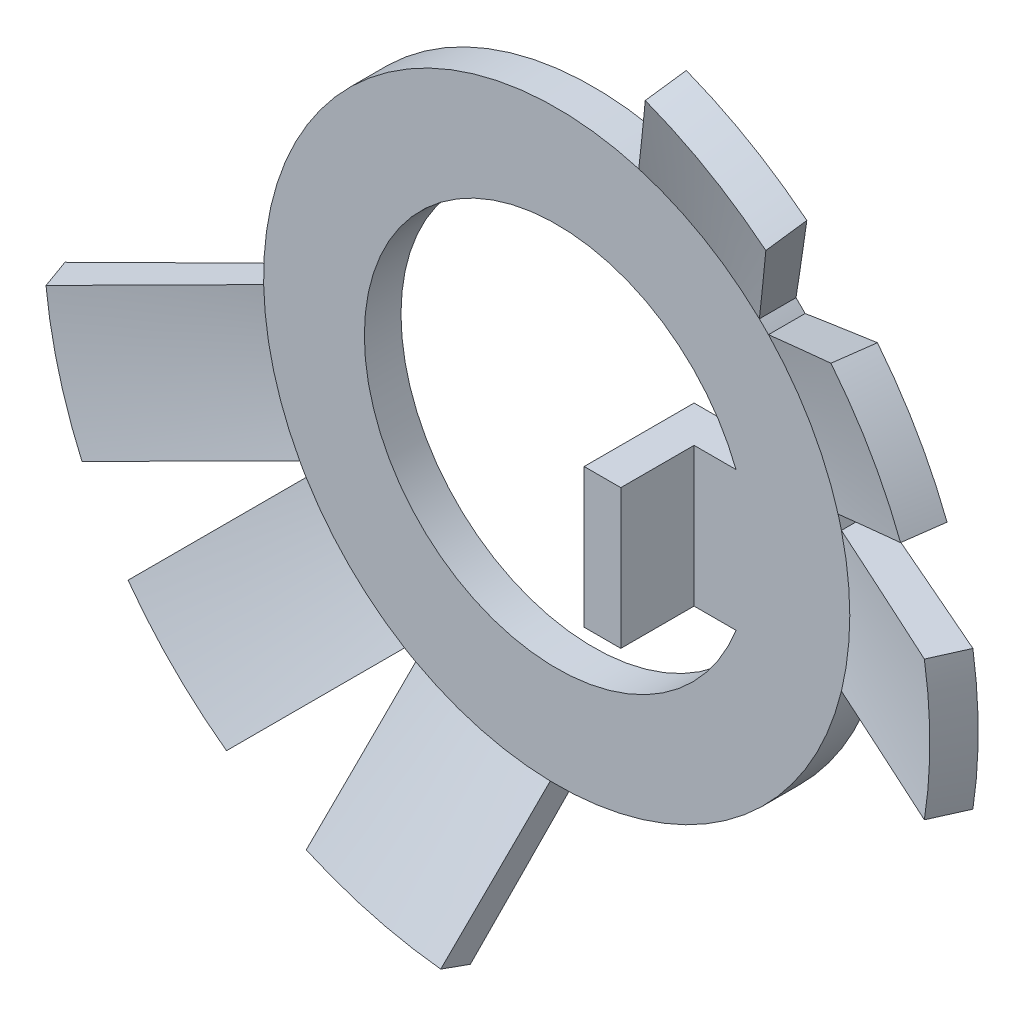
SolidWorks part; units mm, degrees
ref_plane "Front" through (0, 0, 0) normal (0, 0, 1) x (1, 0, 0)
ref_plane "Top" through (0, 0, 0) normal (0, 1, 0) x (1, 0, 0)
ref_plane "Right" through (0, 0, 0) normal (1, 0, 0) x (0, 0, -1)
other "Configuration Table"
sketch "Sketch1" plane through (0, 0, 0) normal (1, 0, 0) x (0, 1, 0)
  line L0 (0, -2.9094) -> (-8, -2.9094)
  line L1 (-8, -2.9094) -> (-12.5, -0.9142)
  line L2 (0, 5.8236) -> (0, -8.1378) construction
  line L4 (-12.0947, 0) -> (-8, -1.9094)
  line L5 (-8, -1.9094) -> (0, -1.9094)
  line L6 (0, -1.9094) -> (0, -2.9094)
  line L7 (-12.5, -0.9142) -> (-12.0947, 0)
revolve "Base-Extrude" add sketch "Sketch1" angle 360 about L2
sketch "Sketch2" plane through (-2.4044, 1.0036, -2.9094) normal (0, 0, -1) x (-1, 0, 0)
  line L0 (-7.2985, 0.8964) -> (-5.1544, 0.8964)
  line L1 (-5.1544, 0.8964) -> (-5.1544, -2.9036)
  line L2 (-5.1544, -2.9036) -> (-7.2985, -2.9036)
  line L3 (-10.1755, -2.9036) -> (-14.7591, -2.9036)
  line L4 (-10.1755, 0.8964) -> (-14.7591, 0.8964)
  line L5 (-8.1843, 4.5274) -> (-12.1539, 6.8193)
  line L6 (-10.0843, 1.2365) -> (-14.0539, 3.5284)
  line L7 (-4.6445, 6.6764) -> (-6.9363, 10.646)
  line L8 (-7.9354, 4.7764) -> (-10.2272, 8.746)
  line L9 (-2.4044, 13.9688) -> (-2.4044, -17.023) construction
  line L10 (-2.4044, -1.0036) -> (1.5148, -15.6299) construction
  line L11 (-2.2283, -9.0016) -> (-1.042, -13.4291)
  line L12 (1.4422, -8.0181) -> (2.6286, -12.4456)
  line L13 (4.4341, -5.1551) -> (7.6753, -8.3962)
  line L14 (1.7471, -7.8421) -> (4.9883, -11.0832)
  line L15 (5.5937, -1.1796) -> (10.0212, -2.366)
  line L16 (4.6102, -4.8501) -> (9.0377, -6.0365)
  line L17 (-2.4044, -1.0036) -> (-2.2283, -9.0016) construction
  arc A0 (-7.2985, -2.9036) -> (-7.2985, 0.8964) centre (-2.4044, -1.0036) ccw
  circle A1 centre (-2.4044, -1.0036) radius 8 construction
  arc A2 (-10.1755, -2.9036) -> (-2.2283, -9.0016) centre (-2.4044, -1.0036) ccw
  arc A4 (-12.1539, 6.8193) -> (-14.0539, 3.5284) centre (-2.4044, -1.0036) ccw
  arc A5 (-7.9354, 4.7764) -> (-8.1843, 4.5274) centre (-2.4044, -1.0036) ccw
  arc A6 (-10.0843, 1.2365) -> (-10.1755, 0.8964) centre (-2.4044, -1.0036) ccw
  arc A7 (-14.7591, 0.8964) -> (-14.7591, -2.9036) centre (-2.4044, -1.0036) ccw
  arc A8 (-6.9363, 10.646) -> (-10.2272, 8.746) centre (-2.4044, -1.0036) ccw
  arc A9 (-1.042, -13.4291) -> (2.6286, -12.4456) centre (-2.4044, -1.0036) ccw
  arc A10 (4.9883, -11.0832) -> (7.6753, -8.3962) centre (-2.4044, -1.0036) ccw
  arc A11 (9.0377, -6.0365) -> (10.0212, -2.366) centre (-2.4044, -1.0036) ccw
  arc A12 (5.5937, -1.1796) -> (-4.6445, 6.6764) centre (-2.4044, -1.0036) ccw
  arc A13 (4.4341, -5.1551) -> (4.6102, -4.8501) centre (-2.4044, -1.0036) ccw
  arc A14 (1.4422, -8.0181) -> (1.7471, -7.8421) centre (-2.4044, -1.0036) ccw
  circle A16 centre (-2.4044, -1.0036) radius 12.5 construction
extrude "Cut-Extrude" cut sketch "Sketch2" against normal through all flip side to cut
sketch "Sketch4" plane through (2.75, -0.6673, -0.255) normal (-1, 0, 0) x (0, 1, 0)
  line L1 (-1.2327, 1.6543) -> (2.5673, 1.6543)
  line L2 (-1.2327, 1.6543) -> (-1.2327, -0.3457)
  line L3 (-1.2327, -0.3457) -> (2.5673, -0.3457)
  line L4 (2.5673, 1.6543) -> (2.5673, -0.3457)
  line L8 (-1.2327, 1.6543) -> (2.5673, 1.6543) construction
  line L9 (2.5673, 1.6543) -> (2.5673, 2.6543) construction
  line L10 (-1.2327, 1.6543) -> (-1.2327, 2.6543) construction
  line L11 (2.5673, 2.6543) -> (-1.2327, 2.6543) construction
  dimension "h" = 3
extrude "Extrude1" add sketch "Sketch4" against normal blind 1
equation "\"D11@Sketch2\" = \"b@Sketch2\" / 2"
equation "\"D6@Sketch2\" = \"b@Sketch2\""
equation "\"D7@Sketch2\" = \"b@Sketch2\" / 2"
equation "\"S1@Sketch1\" = \"S@Sketch1\""
equation "\"b2@Sketch2\" = \"b@Sketch2\" / 2"
equation "\"b1@Sketch2\" = \"b@Sketch2\""
equation "\"D1@Extrude1\"=\"S@Sketch1\""
